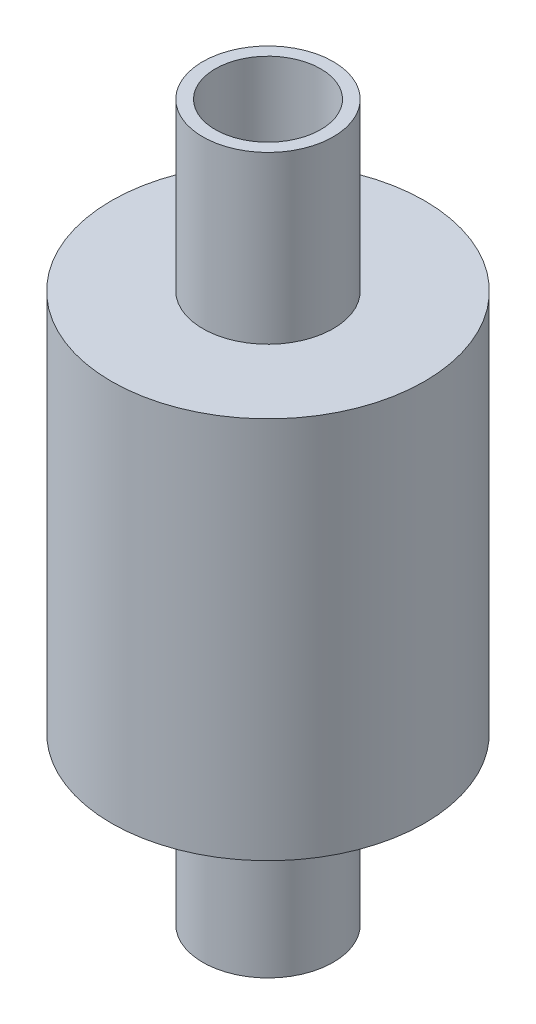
SolidWorks part; units mm, degrees
ref_plane "Front Plane" through (0, 0, 0) normal (0, 0, 1) x (1, 0, 0)
ref_plane "Top Plane" through (0, 0, 0) normal (0, 1, 0) x (1, 0, 0)
ref_plane "Right Plane" through (0, 0, 0) normal (1, 0, 0) x (0, 0, -1)
sketch "Sketch1" plane through (0, 0, 0) normal (0, 0, 1) x (1, 0, 0)
  line L0 (0, 0) -> (0, 82.0135) construction
  line L1 (-3.8481, 0) -> (-3.8481, 52.197)
  line L2 (-3.8481, 52.197) -> (-4.7625, 52.197)
  line L3 (-4.7625, 52.197) -> (-4.7625, 40.0685)
  line L4 (-4.7625, 40.0685) -> (-11.43, 40.0685)
  line L5 (-11.43, 40.0685) -> (-11.43, 12.1285)
  line L6 (-11.43, 12.1285) -> (-4.7625, 12.1285)
  line L7 (-4.7625, 12.1285) -> (-4.7625, 0)
  line L8 (-4.7625, 0) -> (-3.8481, 0)
  dimension "D1" = 7.6962
  dimension "D2" = 9.525
  dimension "D3" = 22.86
  dimension "D4" = 27.94
  dimension "D5" = 52.197
revolve "Revolve1" add sketch "Sketch1" angle 360 about L0
